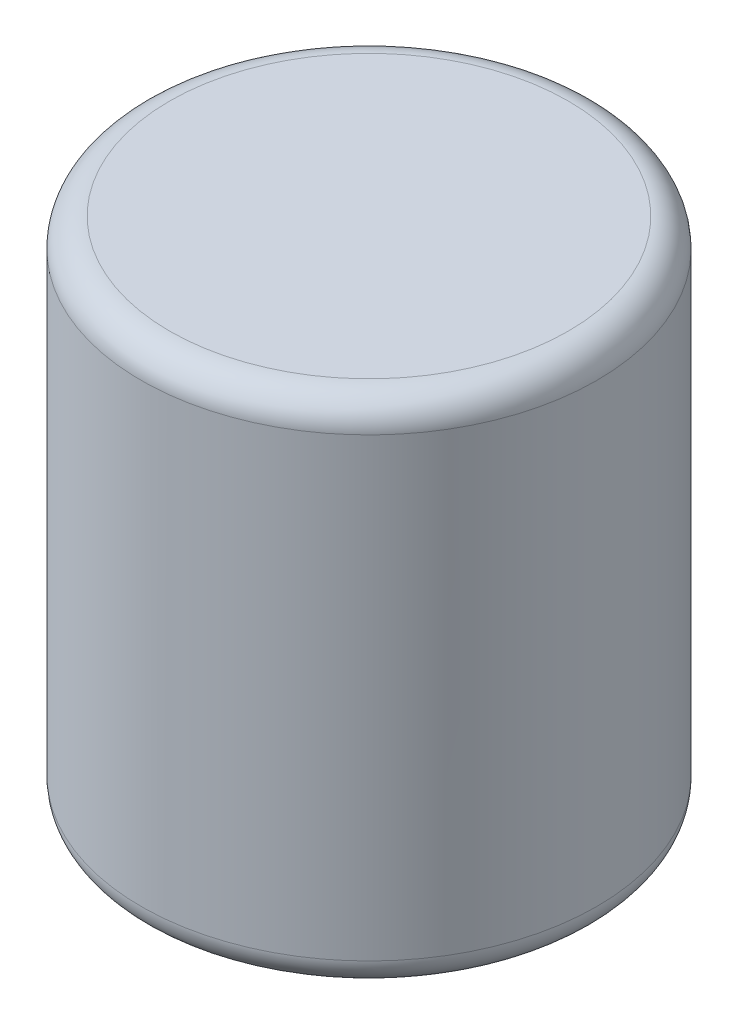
SolidWorks part; units mm, degrees
ref_plane "Front Plane" through (0, 0, 0) normal (0, 0, 1) x (1, 0, 0)
ref_plane "Top Plane" through (0, 0, 0) normal (0, 1, 0) x (1, 0, 0)
ref_plane "Right Plane" through (0, 0, 0) normal (1, 0, 0) x (0, 0, -1)
sketch "Sketch1" plane through (0, 0, 0) normal (0, 0, 1) x (1, 0, 0)
  line L0 (0, 0) -> (0, 18) construction
  line L1 (6.2, 0) -> (8, 0)
  line L2 (8, 0) -> (8, 18)
  line L3 (8, 18) -> (0, 18)
  line L4 (0, 18) -> (0, 16.5)
  line L5 (0, 16.5) -> (5.5, 16.5)
  line L6 (6.5, 14.5) -> (6.5, 0.75)
  line L7 (5.5, 16.5) -> (5.5, 15.25)
  line L8 (5.5, 15.25) -> (6.2, 15.25)
  line L9 (6.5, 0.75) -> (6.2, 0.75)
  line L10 (6.2, 0.75) -> (6.2, 0)
  line L11 (6.2, 15.25) -> (6.2, 14.5)
  line L12 (6.2, 14.5) -> (6.5, 14.5)
  dimension "D1" = 18
  dimension "D2" = 1.5
  dimension "D3" = 1.5
  dimension "D4" = 8
  dimension "D5" = 3.5
  dimension "D7" = 0.3
  dimension "D8" = 0.75
  dimension "D9" = 2.5
revolve "Revolve1" add sketch "Sketch1" angle 360 about L0
fillet "Fillet1" radius 1 2 edges at (8, 0, 0) (8, 18, 0)
